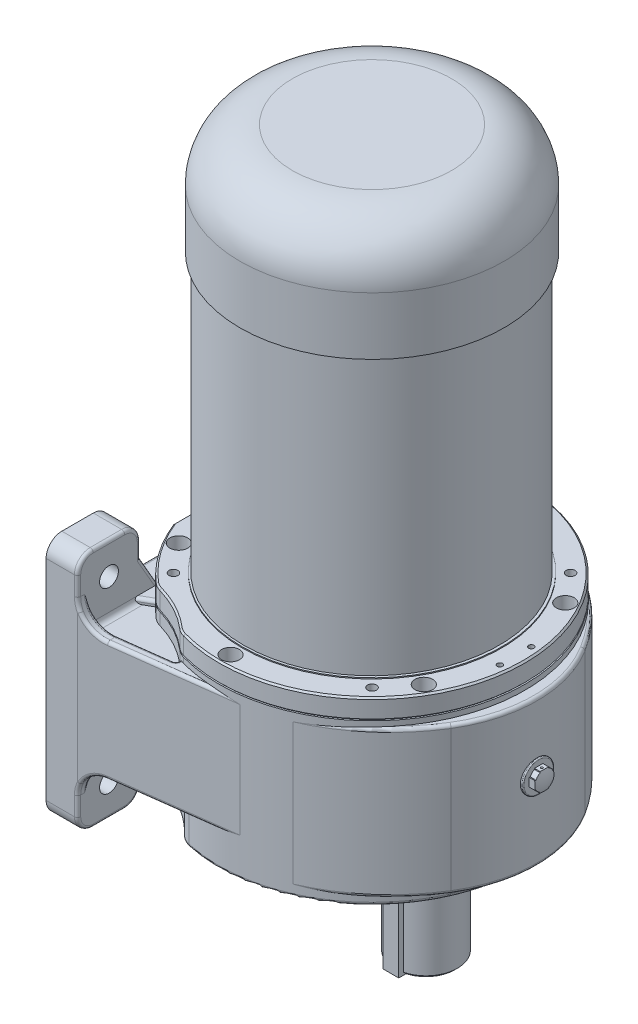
SolidWorks part; units mm, degrees
ref_plane "前视基准面" through (0, 0, 0) normal (0, 0, 1) x (1, 0, 0)
ref_plane "上视基准面" through (0, 0, 0) normal (0, 1, 0) x (1, 0, 0)
ref_plane "右视基准面" through (0, 0, 0) normal (1, 0, 0) x (0, 0, -1)
imported_body "50箱盖-1-surface1"
imported_body "卧式箱体-1-surface1"
imported_body "卧式箱体-1-surface2"
imported_body "复件 5034.2200.106-00-1-surface2"
imported_body "复件 5034.2200.106-00-1-surface3"
imported_body "复件 5034.2200.106-00-1-surface4"
imported_body "复件 5034.2200.106-00-1-surface5"
imported_body "复件 5034.2200.106-00-1-surface6"
imported_body "复件 5034.2200.106-00-1-surface7"
imported_body "复件 5034.2200.106-00-1-surface8"
imported_body "复件 5034.2200.106-00-1-surface9"
imported_body "复件 5034.2200.106-00-1-surface10"
imported_body "复件 5034.2200.106-00-1-surface11"
imported_body "复件 5034.2200.106-00-1-surface12"
imported_body "复件 5034.2200.106-00-1-surface13"
imported_body "复件 5034.2200.106-00-1-surface14"
imported_body "复件 5034.2200.106-00-1-surface15"
imported_body "复件 5034.2200.106-00-1-surface16"
imported_body "复件 5034.2200.106-00-1-surface17"
imported_body "复件 5034.2200.106-00-1-surface18"
imported_body "复件 5034.2200.106-00-1-surface19"
imported_body "复件 5034.2200.106-00-1-surface20"
imported_body "复件 5034.2200.106-00-1-surface21"
imported_body "复件 5034.2200.106-00-1-surface22"
imported_body "复件 5034.2200.106-00-1-surface23"
imported_body "复件 5034.2200.106-00-1-surface24"
imported_body "复件 5034.2200.106-00-1-surface25"
imported_body "复件 5034.2200.106-00-1-surface26"
imported_body "复件 5034.2200.106-00-1-surface27"
imported_body "复件 5034.2200.106-00-1-surface28"
imported_body "复件 5034.2200.106-00-1-surface29"
imported_body "复件 5034.2200.106-00-1-surface30"
imported_body "复件 5034.2200.106-00-1-surface31"
imported_body "复件 5034.2200.106-00-1-surface32"
imported_body "复件 5034.2200.106-00-1-surface33"
imported_body "复件 5034.2200.106-00-1-surface34"
imported_body "复件 5034.2200.106-00-1-surface35"
imported_body "复件 5034.2200.106-00-1-surface36"
imported_body "复件 5034.2200.106-00-1-surface37"
imported_body "复件 5034.2200.106-00-1-surface38"
imported_body "复件 5034.2200.106-00-1-surface39"
imported_body "复件 5034.2200.106-00-1-surface40"
imported_body "复件 5034.2200.106-00-1-surface41"
imported_body "复件 5034.2200.106-00-1-surface42"
imported_body "复件 5034.2200.106-00-1-surface43"
imported_body "复件 5034.2200.106-00-1-surface44"
imported_body "复件 5034.2200.106-00-1-surface45"
imported_body "复件 5034.2200.106-00-1-surface46"
imported_body "复件 5034.2200.106-00-1-surface47"
imported_body "复件 5034.2200.106-00-1-surface48"
imported_body "复件 5034.2200.106-00-1-surface49"
imported_body "复件 5034.2200.106-00-1-surface50"
imported_body "复件 5034.2200.106-00-1-surface51"
imported_body "复件 5034.2200.106-00-1-surface52"
imported_body "复件 5034.2200.106-00-1-surface53"
imported_body "复件 5034.2200.106-00-1-surface54"
imported_body "复件 5034.2200.106-00-1-surface55"
imported_body "复件 5034.2200.106-00-1-surface56"
imported_body "复件 5034.2200.106-00-1-surface57"
imported_body "复件 5034.2200.106-00-1-surface58"
imported_body "复件 5034.2200.106-00-1-surface59"
imported_body "复件 5034.2200.106-00-1-surface60"
imported_body "复件 5034.2200.106-00-1-surface61"
imported_body "透气塞-1-surface1"
sketch "草图1" plane through (0, -196.7551, 0) normal (0, 1, 0) x (1, 0, 0)
  circle A0 centre (15.5509, 127.454) radius 122
  circle A1 centre (67.5509, 127.454) radius 52 construction
extrude "凸台-拉伸1" add sketch "草图1" along normal blind 265.5
sketch "草图2" plane through (0, 68.7449, 0) normal (0, 1, 0) x (1, 0, 0)
  circle A0 centre (16.0509, 127.454) radius 126
extrude "凸台-拉伸2" add sketch "草图2" along normal blind 105 separate body
fillet "圆角1" radius 50 1 edges at (16.0509, 173.7449, -1.454)
sketch "草图8" plane through (0, -395.2551, 0) normal (0, -1, 0) x (1, 0, 0)
  circle A0 centre (67.5509, -127.454) radius 30
extrude "凸台-拉伸3" add sketch "草图8" along normal blind 90 separate body
ref_plane "基准面1" through (0, 0, -97.43) normal (0, 0, 1) x (1, 0, 0)
sketch "草图9" plane through (0, 0, -97.43) normal (0, 0, 1) x (1, 0, 0)
  line L1 (37.5509, -485.2551) -> (97.5509, -485.2551) construction
  line L2 (60.0509, -408.2551) -> (60.0509, -485.2551)
  line L3 (60.0509, -485.2551) -> (75.0509, -485.2551)
  line L4 (75.0509, -485.2551) -> (75.0509, -408.2551)
  arc A0 (75.0509, -408.2551) -> (60.0509, -408.2551) centre (67.5509, -408.2551) ccw
extrude "切除-拉伸5" cut sketch "草图9" against normal blind 6.5
sketch "草图10" plane through (0, 0, -103.93) normal (0, 0, 1) x (1, 0, 0)
  line L0 (60.0509, -408.2551) -> (60.0509, -485.2551)
  line L1 (60.0509, -485.2551) -> (75.0509, -485.2551)
  line L2 (75.0509, -485.2551) -> (75.0509, -408.2551)
  arc A0 (75.0509, -408.2551) -> (60.0509, -408.2551) centre (67.5509, -408.2551) ccw
extrude "凸台-拉伸4" add sketch "草图10" along normal blind 10 separate body
chamfer "倒角1" distance 2.5 angle 45 1 edges at (67.5509, -485.2551, -157.454)
